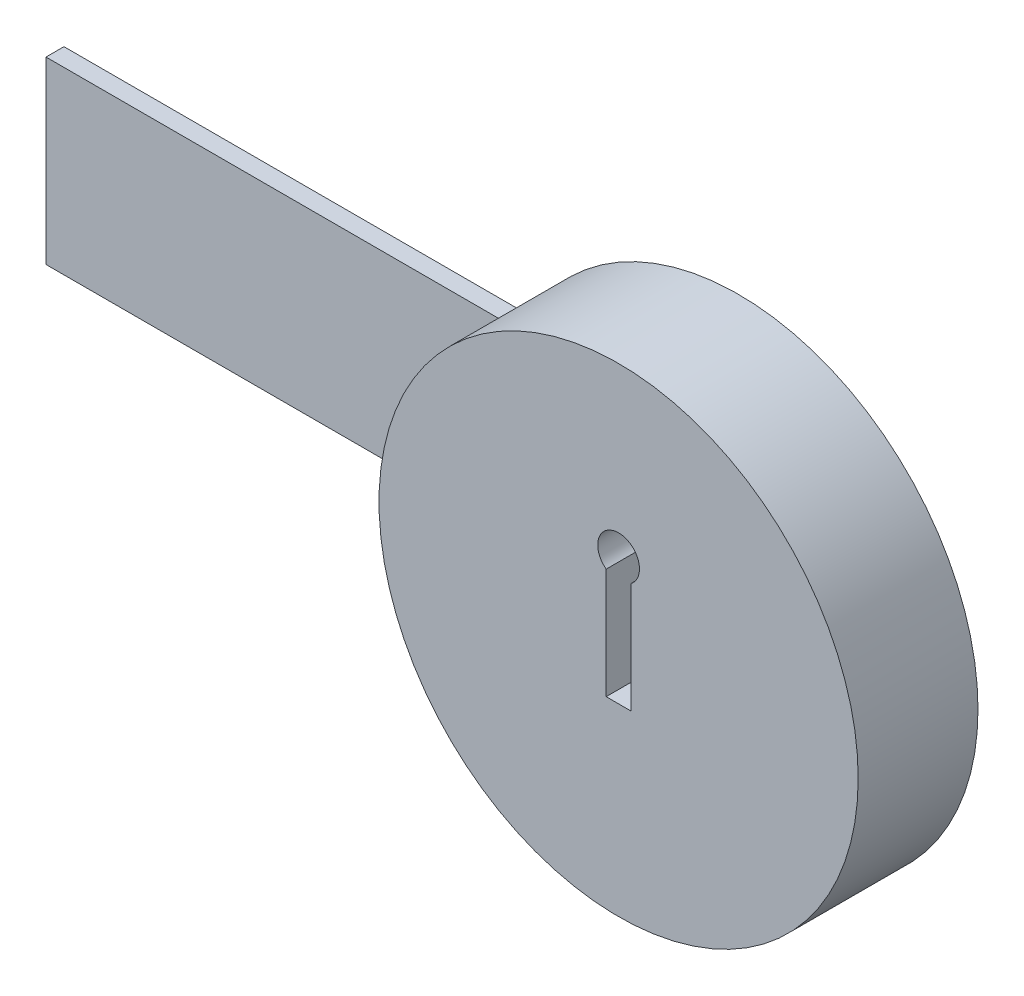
SolidWorks part; units mm, degrees
ref_plane "Front Plane" through (0, 0, 0) normal (0, 0, 1) x (1, 0, 0)
ref_plane "Top Plane" through (0, 0, 0) normal (0, 1, 0) x (1, 0, 0)
ref_plane "Right Plane" through (0, 0, 0) normal (1, 0, 0) x (0, 0, -1)
sketch "Sketch1" plane through (0, 0, 0) normal (0, 0, 1) x (1, 0, 0)
  circle A0 centre (0, 0) radius 20
  dimension "D1" = 40
extrude "Boss-Extrude1" add sketch "Sketch1" along normal blind 10
sketch "Sketch2" plane through (0, 0, 10) normal (0, 0, 1) x (1, 0, 0)
  line L1 (1.0386, -4.6112) -> (-1.0386, -4.6112)
  line L2 (1.0386, -4.6112) -> (1.0386, 4.6112)
  line L4 (-1.0386, -4.6112) -> (-1.0386, 4.6112)
  arc A0 (1.0386, 4.6112) -> (-1.0386, 4.6112) centre (0, 6.0102) ccw
  point P0 (0, 0)
extrude "Cut-Extrude1" cut sketch "Sketch2" against normal blind 5
sketch "Sketch3" plane through (0, 0, 0) normal (0, 0, -1) x (-1, 0, 0)
  line L1 (9.2987, 6.7499) -> (10.7987, 6.7499)
  line L2 (9.2987, 6.7499) -> (9.2987, -8.2501)
  line L3 (9.2987, -8.2501) -> (10.7987, -8.2501)
  line L4 (10.7987, 6.7499) -> (10.7987, -8.2501)
  line L5 (9.2987, 6.7499) -> (10.7987, -8.2501) construction
  line L6 (9.2987, -8.2501) -> (10.7987, 6.7499) construction
  point P0 (10.0487, -0.7501)
  dimension "D1" = 1.5
  dimension "D2" = 15
extrude "Boss-Extrude2" add sketch "Sketch3" along normal blind 3
sketch "Sketch4" plane through (-9.2987, 0, 0) normal (1, 0, 0) x (0, 0, -1)
  line L0 (3, 6.7499) -> (0, 6.7499) construction
  line L1 (1.5, 6.7499) -> (3, 6.7499)
  line L2 (1.5, 6.7499) -> (1.5, -8.2501)
  line L3 (1.5, -8.2501) -> (3, -8.2501)
  line L4 (3, 6.7499) -> (3, -8.2501)
  dimension "D1" = 1.5
  dimension "D2" = 1.5
  dimension "D3" = 1.5
extrude "Boss-Extrude3" add sketch "Sketch4" against normal blind 50
